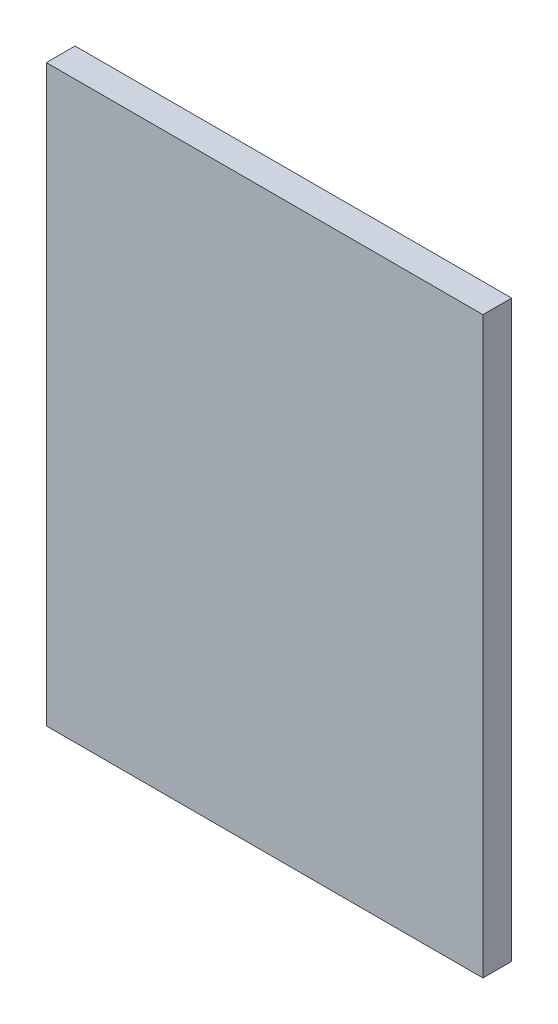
SolidWorks part; units mm, degrees
ref_plane "Front Plane" through (0, 0, 0) normal (0, 0, 1) x (1, 0, 0)
ref_plane "Top Plane" through (0, 0, 0) normal (0, 1, 0) x (1, 0, 0)
ref_plane "Right Plane" through (0, 0, 0) normal (1, 0, 0) x (0, 0, -1)
sketch "Sketch1" plane through (0, 0, 0) normal (0, 0, 1) x (1, 0, 0)
  line L1 (-48.26, -63.5) -> (48.26, -63.5)
  line L2 (-48.26, -63.5) -> (-48.26, 63.5)
  line L3 (-48.26, 63.5) -> (48.26, 63.5)
  line L4 (48.26, -63.5) -> (48.26, 63.5)
  line L5 (-48.26, -63.5) -> (48.26, 63.5) construction
  line L6 (-48.26, 63.5) -> (48.26, -63.5) construction
  point P0 (0, 0)
  dimension "D1" = 127
  dimension "D2" = 96.52
extrude "Boss-Extrude1" add sketch "Sketch1" along normal blind 6.35
sketch "Sketch2" plane through (0, 0, 0) normal (0, 0, -1) x (-1, 0, 0)
  line L0 (-41.91, 57.15) -> (-41.91, -57.15)
  line L1 (-41.91, -57.15) -> (41.91, -57.15)
  line L2 (41.91, -57.15) -> (41.91, 57.15)
  line L3 (41.91, 57.15) -> (-41.91, 57.15)
  line L4 (-48.26, 63.5) -> (-48.26, -63.5)
  line L5 (-48.26, -63.5) -> (48.26, -63.5)
  line L6 (48.26, -63.5) -> (48.26, 63.5)
  line L7 (48.26, 63.5) -> (-48.26, 63.5)
  line L8 (-48.26, 63.5) -> (-48.26, -63.5) construction
  line L9 (-48.26, -63.5) -> (48.26, -63.5) construction
  line L10 (48.26, -63.5) -> (48.26, 63.5) construction
  line L11 (48.26, 63.5) -> (-48.26, 63.5) construction
  line L12 (-39.37, 54.61) -> (-39.37, -54.61)
  line L13 (-39.37, -54.61) -> (39.37, -54.61)
  line L14 (39.37, -54.61) -> (39.37, 54.61)
  line L15 (39.37, 54.61) -> (-39.37, 54.61)
  dimension "D1" = 0
  dimension "D2" = 6.35
  dimension "D3" = 2.54
extrude "Boss-Extrude2" add sketch "Sketch2" along normal blind 6.35
